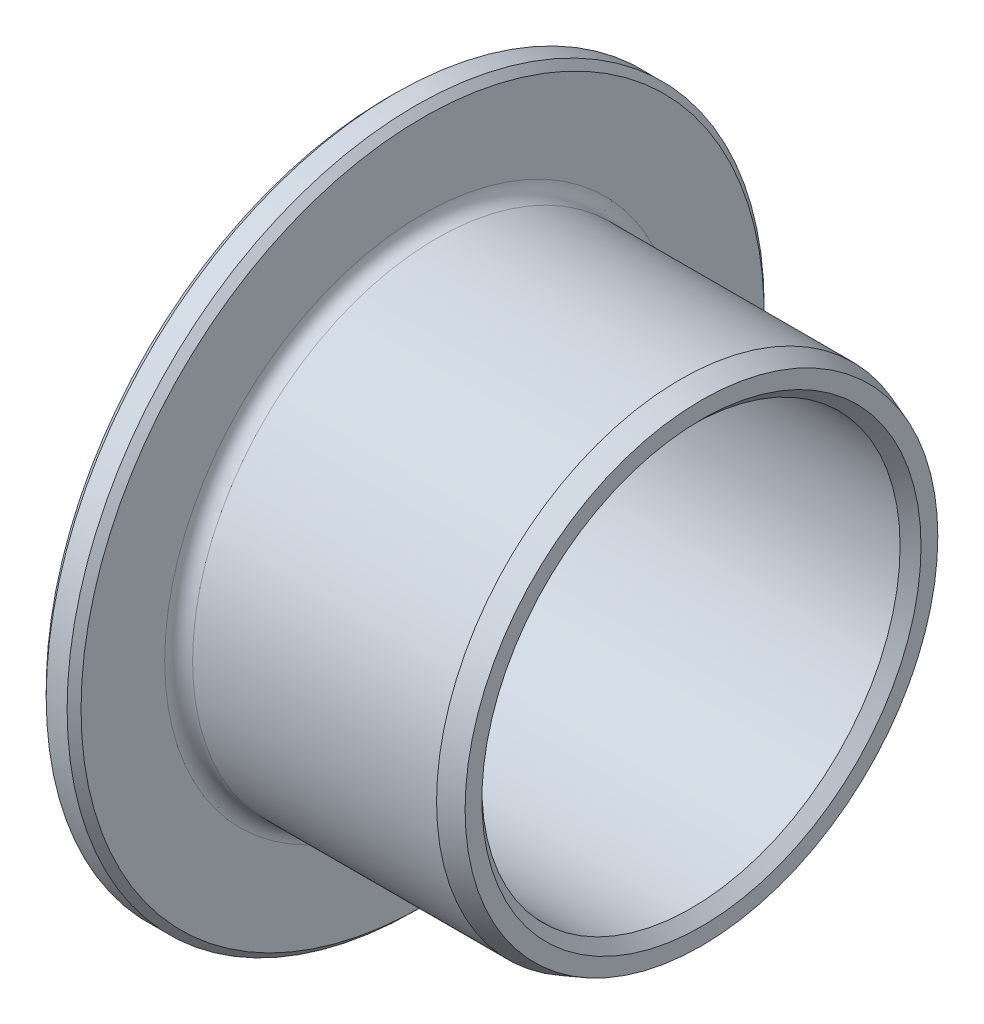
SolidWorks part; units mm, degrees
ref_plane "Face" through (0, 0, 0) normal (0, 0, 1) x (1, 0, 0)
ref_plane "Dessus" through (0, 0, 0) normal (0, 1, 0) x (1, 0, 0)
ref_plane "Droite" through (0, 0, 0) normal (1, 0, 0) x (0, 0, -1)
sketch "Esquisse1" plane through (0, 0, 0) normal (0, 0, 1) x (1, 0, 0)
  line L0 (-1, 6) -> (-1, 10)
  line L1 (-1, 10) -> (0, 10)
  line L2 (0, 10) -> (0, 7)
  line L3 (0, 7) -> (8, 7)
  line L4 (8, 7) -> (8, 6)
  line L5 (8, 6) -> (-1, 6)
  line L6 (-5.3127, 0) -> (18.9323, 0) construction
  dimension "D1" = 10
  dimension "D2" = 6
  dimension "D3" = 1
  dimension "D4" = 7
  dimension "D5" = 9
revolve "Base-Révolution" add sketch "Esquisse1" angle 360 about L6
chamfer "Chanfrein2" distance 0.6 angle 20 1 edges at (8, 0, 7)
chamfer "Chanfrein3" distance 0.3 angle 45 2 edges at (-1, 0, 6) (8, 0, 6)
chamfer "Chanfrein4" distance 0.2 angle 45 2 edges at (0, 0, 10) (-1, 0, 10)
fillet "Congé1" radius 0.4 1 edges at (0, 0, 7)
sketch "Esq_WRNL_Compact001" plane through (0, 0, 0) normal (0, 0, 1) x (1, 0, 0)
  line L0 (-2, -11) -> (-2, 11)
  line L1 (9, -11) -> (9, 11)
  line L2 (-2, -11) -> (9, -11)
  line L3 (-2, 11) -> (9, 11)
